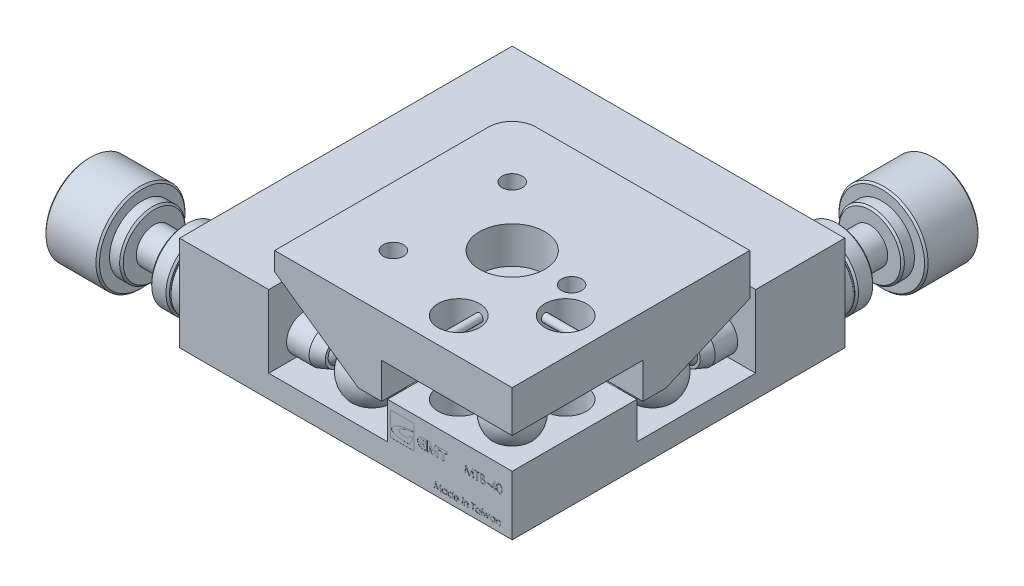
SolidWorks part; units mm, degrees
ref_plane "前基準面" through (0, 0, 0) normal (0, 0, 1) x (1, 0, 0)
ref_plane "上基準面" through (0, 0, 0) normal (0, 1, 0) x (1, 0, 0)
ref_plane "右基準面" through (0, 0, 0) normal (1, 0, 0) x (0, 0, -1)
sketch "草圖1" plane through (0, 0, 0) normal (0, 1, 0) x (1, 0, 0)
  line L1 (0, 0) -> (56, 0)
  line L2 (0, 0) -> (0, 56)
  line L3 (0, 56) -> (56, 56)
  line L4 (56, 0) -> (56, 56)
  dimension "D1" = 56
  dimension "D2" = 56
extrude "伸長1" add sketch "草圖1" along normal blind 16
sketch "草圖2" plane through (0, 16, 0) normal (0, 1, 0) x (1, 0, 0)
  line L1 (56, 0) -> (15, 0)
  line L2 (56, 0) -> (56, 41)
  line L3 (56, 41) -> (15, 41)
  line L4 (15, 0) -> (15, 41)
  dimension "D1" = 41
  dimension "D2" = 41
extrude "除料-伸長1" cut sketch "草圖2" against normal blind 6
sketch "草圖24" plane through (0, 10, 0) normal (0, 1, 0) x (1, 0, 0)
  line L0 (15, 0) -> (56, 0) construction
  line L1 (15, 0) -> (35, 0)
  line L2 (15, 0) -> (15, 14)
  line L3 (15, 14) -> (35, 14)
  line L4 (35, 0) -> (35, 14)
  line L5 (15, 41) -> (15, 0) construction
  point P10 (35, 14)
  dimension "D1" = 14
  dimension "D2" = 20
extrude "除料-伸長7" cut sketch "草圖24" against normal blind 6.2
sketch "草圖25" plane through (0, 10, 0) normal (0, 1, 0) x (1, 0, 0)
  line L1 (56, 41) -> (42, 41)
  line L2 (56, 41) -> (56, 21)
  line L3 (56, 21) -> (42, 21)
  line L4 (42, 41) -> (42, 21)
  point P7 (42, 21)
  dimension "D1" = 14
  dimension "D2" = 20
extrude "除料-伸長8" cut sketch "草圖25" against normal blind 6.2
fillet "圓角3" radius 4 1 edges at (15, 13, -41)
ref_plane "平面1" through (0, 22.2, 0) normal (0, 1, 0) x (-1, 0, 0)
sketch "草圖3" plane through (0, 22.2, 0) normal (0, 1, 0) x (-1, 0, 0)
  line L1 (-56, 0) -> (-16, 0)
  line L2 (-56, 0) -> (-56, -40)
  line L3 (-56, -40) -> (-16, -40)
  line L4 (-16, 0) -> (-16, -40)
  dimension "D1" = 40
  dimension "D2" = 40
extrude "伸長2" add sketch "草圖3" against normal blind 13
fillet "圓角2" radius 4 1 edges at (16, 19.1, -40)
sketch "草圖4" plane through (0, 0, 0) normal (0, 0, 1) x (1, 0, 0)
  line L0 (16, 19.0729) -> (16, 9.2)
  line L1 (16, 9.2) -> (30.1, 9.2)
  line L6 (16, 19.0729) -> (30.1, 9.2)
  line L7 (16, 9.2) -> (16, 22.2) construction
  dimension "D1" = 125
  dimension "D4" = 14.1
extrude "除料-伸長4" cut sketch "草圖4" against normal blind 11
sketch "草圖7" plane through (56, 0, 0) normal (1, 0, 0) x (0, 0, -1)
  line L0 (25.8649, 9.2) -> (40, 15.2)
  line L3 (40, 15.2) -> (40, 9.2)
  line L4 (25.8649, 9.2) -> (40, 9.2)
  line L7 (21, 9.2) -> (40, 9.2) construction
  line L8 (40, 9.2) -> (40, 22.2) construction
  dimension "D1" = 113
  dimension "D2" = 15.3558
extrude "除料-伸長5" cut sketch "草圖7" against normal blind 11
ref_plane "平面3" through (0, 10, 0) normal (0, 1, 0) x (-1, 0, 0)
sketch "草圖10" plane through (0, 10, 0) normal (0, 1, 0) x (-1, 0, 0)
  line L0 (-56, -40) -> (-20, -40) construction
  line L1 (-45, -11) -> (-16, -11)
  line L2 (-45, -11) -> (-45, -40)
  line L3 (-45, -40) -> (-20, -40)
  line L4 (-16, -11) -> (-16, -36)
  line L5 (-16, -36) -> (-16, 0) construction
  arc A0 (-20, -40) -> (-16, -36) centre (-20, -36) ccw
  dimension "D3" = 4
  dimension "D1" = 29
  dimension "D2" = 29
extrude "除料-伸長6" cut sketch "草圖10" along normal blind 6
sketch "草圖43" plane through (0, 0, 0) normal (0, 0, 1) x (1, 0, 0)
  line L0 (56, 22.2) -> (56, 0) construction
  line L1 (56, 10) -> (34, 10)
  line L2 (56, 10) -> (56, 15.2)
  line L3 (56, 15.2) -> (34, 15.2)
  line L4 (34, 10) -> (34, 15.2)
  line L5 (0, 0) -> (56, 0) construction
  dimension "D1" = 22
  dimension "D2" = 10
  dimension "D3" = 5.2
extrude "除料-伸長13" cut sketch "草圖43" against normal blind 22
sketch "草圖44" plane through (0, 10, 0) normal (0, 1, 0) x (-1, 0, 0)
  line L0 (-56, -21) -> (-42, -21)
  line L2 (-56, 0) -> (-56, -40) construction
  line L3 (-42, -21) -> (-42, -40)
  line L4 (-56, -40) -> (-20, -40) construction
  line L5 (-42, -40) -> (-45, -40)
  line L6 (-45, -40) -> (-45, -22)
  line L7 (-45, -22) -> (-56, -22)
  line L8 (-56, -22) -> (-56, -21)
  dimension "D1" = 3
  dimension "D2" = 1
  dimension "D3" = 18
  dimension "D4" = 11
extrude "除料-伸長14" cut sketch "草圖44" against normal blind 5
sketch "草圖45" plane through (0, 10, 0) normal (0, 1, 0) x (-1, 0, 0)
  line L0 (-35, 0) -> (-35, -14)
  line L1 (-16, 0) -> (-56, 0) construction
  line L2 (-35, -14) -> (-16, -14)
  line L3 (-16, -36) -> (-16, 0) construction
  line L4 (-16, -14) -> (-16, -11)
  line L5 (-16, -11) -> (-34, -11)
  line L6 (-34, -11) -> (-34, 0)
  line L7 (-34, 0) -> (-35, 0)
  line L8 (-30.1, 0) -> (-16, 0) construction
  point P4 (-23.05, 0)
  dimension "D1" = 1
  dimension "D2" = 3
  dimension "D3" = 11
  dimension "D4" = 18
extrude "除料-伸長15" cut sketch "草圖45" against normal blind 5
fillet "圓角4" radius 5 2 edges at (42, 6.9, -21) (35, 6.9, -14)
ref_plane "平面4" through (0, 6.8, 0) normal (0, -1, 0) x (1, 0, 0)
sketch "草圖17" plane through (0, 6.8, 0) normal (0, -1, 0) x (1, 0, 0)
  line L0 (50, -56) -> (55.45, -56)
  line L1 (56, -61) -> (56, -58)
  line L2 (57.5, -77.2316) -> (50, -77.2316)
  line L4 (56, -58) -> (55.45, -58)
  line L5 (53, -61) -> (56, -61)
  line L6 (55.5, -66.2316) -> (53, -66.2316)
  line L7 (57.5, -68.2316) -> (55.5, -68.2316)
  line L10 (55.75, -56.3) -> (55.75, -57.7)
  line L11 (55.75, -57.7) -> (55.45, -58)
  line L12 (55.45, -56) -> (55.75, -56.3)
  line L13 (53, -61) -> (53, -66.2316)
  line L15 (55.5, -66.2316) -> (55.5, -68.2316)
  line L16 (57.5, -68.2316) -> (57.5, -77.2316)
  line L17 (50, -56) -> (50, -77.2316)
  line L18 (50, -85.1872) -> (50, -42.7621) construction
  line L20 (56, -41) -> (56, -56) construction
  line L21 (56, -56) -> (0, -56) construction
  point P2 (0, 0)
  dimension "D2" = 6
  dimension "D3" = 7.5
  dimension "D4" = 9
  dimension "D5" = 21.2316
  dimension "D6" = 5.5
  dimension "D7" = 3
  dimension "D8" = 12
  dimension "D9" = 11.5
  dimension "D14" = 2
  dimension "D19" = 3
  dimension "D20" = 5.2317
  dimension "D21" = 0.3
  dimension "D22" = 0.3
  dimension "D23" = 0.3
  dimension "D24" = 0.3
revolve "旋轉-薄件1" add sketch "草圖17" angle 360 about L18
chamfer "導角1" distance 0.3 angle 45 6 edges at (44.5501, 6.8, -58) (44, 6.8, -58) (44, 6.8, -61) (44.5, 6.8, -66.2316) (42.5, 6.8, -68.2316) (42.5, 6.8, -77.2316)
sketch "草圖19" plane through (0, 6.8, 0) normal (0, -1, 0) x (1, 0, 0)
  line L0 (50, -24.2869) -> (50, -85.3982) construction
  line L1 (50, -41) -> (52.975, -41)
  line L2 (52.975, -41) -> (52.975, -37.2)
  line L3 (52.975, -37.2) -> (52.3, -35.3455)
  line L5 (56, 0) -> (56, -40) construction
  line L6 (50, -34.1) -> (50, -41)
  line L7 (56, -41) -> (19, -41) construction
  line L8 (52.3, -35.3455) -> (51.8522, -35.3455)
  arc A0 (51.8522, -35.3455) -> (50, -34.1) centre (50, -36.1) ccw
  dimension "D5" = 20
  dimension "D4" = 4
  dimension "D7" = 3.8
  dimension "D2" = 6
  dimension "D3" = 5.95
  dimension "D6" = 6.9
  dimension "D8" = 2.3
revolve "旋轉7" add sketch "草圖19" angle 360 about L0
sketch "草圖22" plane through (0, 6.8, 0) normal (0, -1, 0) x (1, 0, 0)
  line L0 (0, -6) -> (0, -0.55)
  line L1 (-5, 0) -> (-2, 0)
  line L2 (-21.3, 1.5) -> (-21.3, -6)
  line L3 (0, 0) -> (15, 0) construction
  line L4 (-2, 0) -> (-2, -0.55)
  line L5 (-5, -3) -> (-5, 0)
  line L6 (-10.3, -0.5) -> (-10.3, -3)
  line L7 (-12.3, 1.5) -> (-12.3, -0.5)
  line L8 (0, -56) -> (0, 0) construction
  line L9 (0, -6) -> (-21.3, -6)
  line L10 (-0.3, -0.25) -> (-1.7, -0.25)
  line L11 (-1.7, -0.25) -> (-2, -0.55)
  line L12 (0, -0.55) -> (-0.3, -0.25)
  line L13 (-5, -3) -> (-10.3, -3)
  line L15 (-10.3, -0.5) -> (-12.3, -0.5)
  line L16 (-12.3, 1.5) -> (-21.3, 1.5)
  line L18 (38.7378, -6) -> (-35.4089, -6) construction
  dimension "D1" = 6
  dimension "D2" = 14.9999
  dimension "D3" = 10.9999
  dimension "D4" = 5.9999
  dimension "D5" = 11.9999
  dimension "D6" = 5.75
  dimension "D7" = 9
  dimension "D8" = 21.3
  dimension "D9" = 2
  dimension "D10" = 5.3
  dimension "D11" = 0.3
  dimension "D12" = 0.3
  dimension "D13" = 0.3
  dimension "D14" = 0.3
  dimension "D15" = 3
revolve "旋轉8" add sketch "草圖22" angle 360 about L18
chamfer "導角2" distance 0.3 angle 45 5 edges at (-21.3, 6.8, -13.5) (-12.3, 6.8, -13.5) (-10.3, 6.8, -11.5) (-5, 6.8, -12) (-2, 6.8, -12)
sketch "草圖23" plane through (0, 6.8, 0) normal (0, -1, 0) x (1, 0, 0)
  line L0 (35.4631, -6) -> (-29.8584, -6) construction
  line L1 (15, -6) -> (15, -3.001)
  line L2 (15, -37) -> (15, -14) construction
  line L3 (15, -3.001) -> (18.8, -3.001)
  line L4 (18.8, -3.001) -> (20.8, -3.7289)
  line L5 (20.8, -3.7289) -> (20.8, -4.2139)
  line L7 (16, 0) -> (56, 0) construction
  line L9 (15, -6) -> (21.9, -6)
  arc A0 (21.9, -6) -> (20.8, -4.2139) centre (19.9, -6) ccw
  dimension "D1" = 4
  dimension "D3" = 6.9
  dimension "D2" = 6
  dimension "D4" = 3.8
  dimension "D5" = 2.999
  dimension "D6" = 20
  dimension "D7" = 5.8
revolve "旋轉9" add sketch "草圖23" angle 360 about L0
hole_wizard "M6 承窩頭蓋螺釘的柱孔1" positions "草圖27" profile "草圖26" counterbore size "M6" standard "JIS"
sketch "草圖27" plane through (0, 22.2, 0) normal (0, 1, 0) x (-1, 0, 0)
  line L0 (-56, 0) -> (-56, -40) construction
  line L1 (-16, 0) -> (-56, 0) construction
  point P0 (-36, -20)
  dimension "D1" = 20
  dimension "D2" = 20
sketch "草圖26" plane through (36, 22.2, -20) normal (1, 0, 0) x (0, 0, 1)
  line L0 (0, 0) -> (0, 22.9)
  line L1 (0, 22.9) -> (3.3, 22.9)
  line L3 (3.3, 22.9) -> (3.3, 18.8)
  line L4 (3.3, 18.8) -> (5.5, 18.8)
  line L5 (5.5, 18.8) -> (5.5, 0)
  line L7 (5.5, 0) -> (0, 0)
  line L11 (0, -6.35) -> (0, 107.95) construction
  dimension "貫穿孔直徑" = 6.6
  dimension "貫穿孔深度" = 22.9
  dimension "柱孔直徑" = 11
  dimension "柱孔深度" = 18.8
hole_wizard "M4x0.7 螺紋孔2" positions "草圖33" profile "草圖32" tap size "M4x0.7" standard "JIS"
sketch "草圖33" plane through (0, 22.2, 0) normal (0, 1, 0) x (-1, 0, 0)
  line L1 (-16, 0) -> (-56, 0) construction
  line L2 (-56, -21) -> (-56, -41) construction
  line L3 (-56, 0) -> (-56, -40) construction
  point P0 (-26, -30)
  point P1 (-26, -10)
  point P3 (-46, -20)
  dimension "D1" = 10
  dimension "D2" = 20
  dimension "D3" = 10
  dimension "D4" = 10
  dimension "D5" = 10
  dimension "D6" = 30
sketch "草圖32" plane through (26, 22.2, -30) normal (1, 0, 0) x (0, 0, 1)
  line L0 (0, 0) -> (0, 10.5215)
  line L1 (0, 10.5215) -> (1.7, 9.5)
  line L2 (1.7, 9.5) -> (1.7, 0)
  line L5 (1.7, 0) -> (0, 0)
  line L10 (0, 10.5215) -> (-1.7, 9.5) construction
  line L11 (0, -6.35) -> (0, 107.95) construction
  dimension "螺孔鑽直徑" = 3.4
  dimension "螺孔鑽深度" = 9.5
  dimension "導頭角度" = 118
hole_wizard "Ø7.0 (7) 直徑孔1" positions "草圖31" profile "草圖30" hole size "Ø7.0" standard "JIS"
sketch "草圖31" plane through (0, 22.2, 0) normal (0, 1, 0) x (-1, 0, 0)
  line L0 (-56, 0) -> (-56, -40) construction
  line L1 (-16, 0) -> (-56, 0) construction
  point P0 (-50, -15)
  point P1 (-41, -6)
  dimension "D1" = 6
  dimension "D2" = 15
  dimension "D3" = 6
  dimension "D4" = 15
sketch "草圖30" plane through (50, 22.2, -15) normal (1, 0, 0) x (0, 0, 1)
  line L0 (0, 0) -> (0, 22.9)
  line L1 (0, 22.9) -> (3.5, 22.9)
  line L2 (3.5, 22.9) -> (3.5, 0)
  line L5 (3.5, 0) -> (0, 0)
  line L11 (0, -6.35) -> (0, 107.95) construction
  dimension "貫穿孔直徑" = 7
  dimension "貫穿孔深度" = 22.9
sketch "草圖34" plane through (0, 0, 0) normal (0, 0, 1) x (1, 0, 0)
  line L0 (56, 22.2) -> (56, 15.2) construction
  circle A0 centre (41, 20.2) radius 0.65
  circle A1 centre (41, 2) radius 0.65
  dimension "D1" = 1.3
  dimension "D2" = 1.3
  dimension "D3" = 18.2
  dimension "D4" = 2
  dimension "D5" = 15
extrude "伸長3" add sketch "草圖34" against normal blind 12
sketch "草圖35" plane through (56, 0, 0) normal (1, 0, 0) x (0, 0, -1)
  line L0 (0, 0) -> (56, 0) construction
  line L1 (0, 22.2) -> (0, 15.2) construction
  circle A0 centre (15, 20.2) radius 0.65
  circle A1 centre (15, 2) radius 0.65
  dimension "D1" = 1.3
  dimension "D2" = 1.3
  dimension "D4" = 2
  dimension "D3" = 18.2
  dimension "D5" = 15
extrude "伸長4" add sketch "草圖35" against normal blind 12
ref_plane "平面5" through (26.4, 0, 0) normal (-1, 0, 0) x (0, 0, 1)
sketch "草圖36" plane through (26.4, 0, 0) normal (-1, 0, 0) x (0, 0, 1)
  line L0 (-6, 29.8256) -> (-6, -4.9751) construction
  line L1 (0, 19.0729) -> (0, 22.2) construction
  line L2 (-56, 0) -> (0, 0) construction
  line L3 (-6, 2.3) -> (-6, 11.3)
  arc A0 (-6, 11.3) -> (-6, 2.3) centre (-6, 6.8) ccw
  dimension "D2" = 9
  dimension "D1" = 6
  dimension "D3" = 6.8
revolve "旋轉10" add sketch "草圖36" angle 360 about L0
ref_plane "平面6" through (0, 0, -29.6) normal (0, 0, -1) x (-1, 0, 0)
sketch "草圖37" plane through (0, 0, -29.6) normal (0, 0, -1) x (-1, 0, 0)
  line L0 (-50, 28.3619) -> (-50, -7.4552) construction
  line L1 (-56, 15.2) -> (-56, 22.2) construction
  line L2 (-56, 0) -> (0, 0) construction
  line L3 (-50, 2.3) -> (-50, 11.3)
  arc A0 (-50, 11.3) -> (-50, 2.3) centre (-50, 6.8) ccw
  dimension "D1" = 9
  dimension "D3" = 6.8
  dimension "D2" = 6
revolve "旋轉11" add sketch "草圖37" angle 360 about L0
ref_plane "平面7" through (0, 0, -6) normal (0, 0, 1) x (1, 0, 0)
sketch "草圖38" plane through (0, 0, -6) normal (0, 0, 1) x (1, 0, 0)
  line L0 (50, 26.9805) -> (50, -3.8044) construction
  line L1 (56, 22.2) -> (56, 15.2) construction
  line L2 (16, 22.2) -> (56, 22.2) construction
  arc A0 (50, 15.8) -> (50, 9.4) centre (50, 12.6) ccw
  dimension "D2" = 6.4
  dimension "D1" = 6
  dimension "D3" = 9.6
revolve "旋轉-薄件2" add sketch "草圖38" angle 360 about L0
sketch "草圖39" plane through (0, 0, 0) normal (0, 0, 1) x (1, 0, 0)
  line L0 (35.5, 4.6971) -> (39.4988, 4.6971)
  line L1 (39.4988, 4.6971) -> (39.4988, 8.7)
  line L2 (35.5, 8.7) -> (35.5, 4.6971)
  line L3 (35.5, 8.7) -> (39.4988, 8.7)
  line L4 (35, 10) -> (35, 3.8) construction
  line L5 (35, 10) -> (56, 10) construction
  dimension "D1" = 3.9988
  dimension "D2" = 4.0029
  dimension "D3" = 0.5
  dimension "D4" = 1.3
extrude "除料-伸長9" cut sketch "草圖39" against normal blind 0.01
sketch "草圖40" plane through (0, 0, 0) normal (0, 0, 1) x (1, 0, 0)
  line L4 (44.5558, 6.9191) -> (44.5558, 5.7279)
  line L5 (44.5558, 6.9191) -> (44.9545, 6.9191)
  line L6 (45.0796, 7.0442) -> (45.0796, 7.323)
  line L7 (45.0796, 7.323) -> (43.6354, 7.323)
  line L8 (43.6354, 7.323) -> (43.6354, 6.9266)
  line L9 (43.6354, 6.9266) -> (44.1523, 6.9266)
  line L10 (44.1523, 6.9266) -> (44.1523, 5.8552)
  line L11 (44.2764, 5.7301) -> (44.5558, 5.7279)
  line L12 (43.5264, 7.323) -> (43.0744, 7.323)
  line L13 (42.1393, 7.323) -> (41.6873, 7.323)
  line L14 (41.5833, 7.323) -> (40.7405, 7.323)
  line L15 (41.6873, 7.323) -> (41.6873, 5.7311)
  line L16 (43.5264, 5.7311) -> (43.2577, 5.7311)
  line L17 (42.7238, 5.7311) -> (42.4899, 5.7311)
  line L18 (41.956, 5.7311) -> (41.6873, 5.7311)
  line L19 (41.5746, 5.7311) -> (40.7405, 5.7311)
  line L20 (42.1393, 7.323) -> (42.6068, 6.239)
  line L21 (42.0811, 6.6567) -> (42.0811, 5.8562)
  line L22 (42.0811, 6.6567) -> (42.4899, 5.7311)
  line L23 (43.5264, 7.323) -> (43.5264, 5.7311)
  line L24 (43.1326, 6.6567) -> (43.1326, 5.8562)
  line L25 (43.1326, 6.6567) -> (42.7238, 5.7311)
  line L26 (43.0744, 7.323) -> (42.6068, 6.239)
  line L27 (41.5746, 6.7114) -> (40.7702, 6.7114)
  line L28 (41.5746, 6.7114) -> (41.5746, 5.7311)
  line L29 (40.7702, 6.7114) -> (40.7702, 6.4969)
  line L30 (41.2283, 6.3718) -> (40.8953, 6.3718)
  line L31 (41.2283, 6.3718) -> (41.2283, 6.0673)
  line L32 (41.2283, 6.0673) -> (40.7405, 6.0673)
  line L33 (41.5833, 7.323) -> (41.5833, 7.1241)
  line L34 (40.7405, 6.999) -> (41.4582, 6.999)
  line L35 (38.7856, 5.2865) -> (39.2864, 6.5589)
  line L36 (39.2864, 6.5589) -> (38.8352, 6.5586)
  line L37 (38.8352, 6.5586) -> (38.4123, 6.015)
  line L38 (39.9438, 7.5637) -> (39.9438, 7.4481)
  line L39 (38.7856, 5.2865) -> (37.6005, 5.28)
  arc A0 (44.9545, 6.9191) -> (45.0796, 7.0442) centre (44.9545, 7.0442) ccw
  arc A1 (44.1523, 5.8552) -> (44.2764, 5.7301) centre (44.2774, 5.8552) ccw
  arc A2 (41.956, 5.7311) -> (42.0811, 5.8562) centre (41.956, 5.8562) ccw
  arc A3 (43.1326, 5.8562) -> (43.2577, 5.7311) centre (43.2577, 5.8562) ccw
  arc A4 (40.7702, 6.4969) -> (40.8953, 6.3718) centre (40.8953, 6.4969) ccw
  arc A5 (41.4582, 6.999) -> (41.5833, 7.1241) centre (41.4582, 7.1241) ccw
  arc A6 (40.7405, 6.999) -> (40.7405, 6.0673) centre (41.0311, 6.5332) ccw
  arc A7 (40.7405, 7.323) -> (40.7405, 5.7311) centre (40.8764, 6.5271) ccw
  arc A8 (37.8244, 6.0369) -> (38.4123, 6.015) centre (38.3499, 12.2321) ccw
  arc A9 (37.3432, 6.1011) -> (37.8244, 6.0369) centre (37.8475, 8.0477) ccw
  arc A10 (36.969, 6.2543) -> (37.3432, 6.1011) centre (37.5233, 7.0748) ccw
  arc A11 (36.8748, 6.4178) -> (36.969, 6.2543) centre (37.0627, 6.4171) ccw
  arc A12 (36.9341, 6.5529) -> (36.8748, 6.4178) centre (37.1315, 6.3856) ccw
  arc A13 (37.1355, 6.7316) -> (36.9341, 6.5529) centre (37.5865, 6.0207) ccw
  arc A14 (37.4075, 6.8798) -> (37.1355, 6.7316) centre (38.2927, 4.9308) ccw
  arc A15 (37.4075, 6.8798) -> (37.7452, 7.0129) centre (34.8434, 13.8777) ccw
  arc A16 (37.7452, 7.0129) -> (38.0478, 7.1032) centre (30.6085, 31.4826) ccw
  arc A17 (38.3479, 7.182) -> (38.0478, 7.1032) centre (38.6213, 5.5287) ccw
  arc A18 (38.3479, 7.182) -> (38.5993, 7.2345) centre (38.0533, 9.2203) ccw
  arc A19 (38.9208, 7.2966) -> (38.5993, 7.2345) centre (40.6135, -2.3292) ccw
  arc A20 (38.9208, 7.2966) -> (39.2247, 7.351) centre (38.6315, 9.7897) ccw
  arc A21 (39.2247, 7.351) -> (39.4948, 7.3922) centre (39.1211, 8.934) ccw
  arc A22 (39.7423, 7.4264) -> (39.4948, 7.3922) centre (42.3895, -12.6676) ccw
  arc A23 (39.9438, 7.4481) -> (39.7423, 7.4264) centre (39.9974, 6.0063) ccw
  arc A24 (37.6005, 5.28) -> (37.2031, 5.3149) centre (34.0743, -32.5215) ccw
  arc A25 (36.7597, 5.3715) -> (37.2031, 5.3149) centre (37.791, 11.6841) ccw
  arc A26 (36.1764, 5.5221) -> (36.7597, 5.3715) centre (37.4044, 9.0745) ccw
  arc A27 (35.7826, 5.7752) -> (36.1764, 5.5221) centre (36.6314, 6.6631) ccw
  arc A28 (35.6813, 6.0142) -> (35.7826, 5.7752) centre (35.9989, 6.0078) ccw
  arc A29 (35.8107, 6.3263) -> (35.6813, 6.0142) centre (36.2266, 5.971) ccw
  arc A30 (36.1145, 6.6243) -> (35.8107, 6.3263) centre (37.0843, 5.332) ccw
  arc A31 (36.4802, 6.8324) -> (36.1145, 6.6243) centre (38.5339, 2.7977) ccw
  arc A32 (36.8291, 6.9905) -> (36.4802, 6.8324) centre (38.3238, 3.2287) ccw
  arc A33 (37.0751, 7.0775) -> (36.8291, 6.9905) centre (55.0771, -44.2078) ccw
  arc A34 (37.4316, 7.1807) -> (37.0751, 7.0775) centre (38.1765, 3.9398) ccw
  arc A35 (37.8024, 7.2746) -> (37.4316, 7.1807) centre (38.8729, 2.2687) ccw
  arc A36 (38.1498, 7.3418) -> (37.8024, 7.2746) centre (39.9899, -3.1131) ccw
  arc A37 (38.1498, 7.3418) -> (38.4508, 7.3988) centre (37.7318, 10.3689) ccw
  arc A38 (38.7208, 7.4369) -> (38.4508, 7.3988) centre (38.8001, 5.8975) ccw
  arc A39 (39.0354, 7.474) -> (38.7208, 7.4369) centre (39.1598, 5.0658) ccw
  arc A40 (39.3146, 7.5101) -> (39.0354, 7.474) centre (39.5388, 4.6762) ccw
  arc A41 (39.5716, 7.5352) -> (39.3146, 7.5101) centre (40.0638, 1.1847) ccw
  arc A42 (39.4256, 7.5222) -> (39.7559, 7.5531) centre (37.6003, 28.833) ccw
  arc A43 (39.9438, 7.5637) -> (39.7559, 7.5531) centre (39.9232, 6.2653) ccw
extrude "除料-伸長10" cut sketch "草圖40" against normal blind 0.02 and the other way through all
sketch "草圖41" plane through (0, 0, 0) normal (0, 0, 1) x (1, 0, 0)
  line L0 (56, 5.7) -> (46.6157, 5.7) construction
  line L3 (0, 0) -> (56, 0) construction
  line L4 (56, 10) -> (56, 0) construction
  text T0 "MTB-40   " font "Century Gothic" height 1.4
  dimension "D1" = 5.7
extrude "除料-伸長11" cut sketch "草圖41" against normal blind 0.02
sketch "草圖42" plane through (0, 0, 0) normal (0, 0, 1) x (1, 0, 0)
  line L0 (55, 1) -> (42.3476, 1) construction
  line L1 (56, 10) -> (56, 0) construction
  line L2 (0, 0) -> (56, 0) construction
  text T1 "<i>Made in Taiwan</i>  " font "Century Gothic" height in points 3
  dimension "D1" = 1
  dimension "D2" = 1
extrude "除料-伸長12" cut sketch "草圖42" against normal blind 0.02
